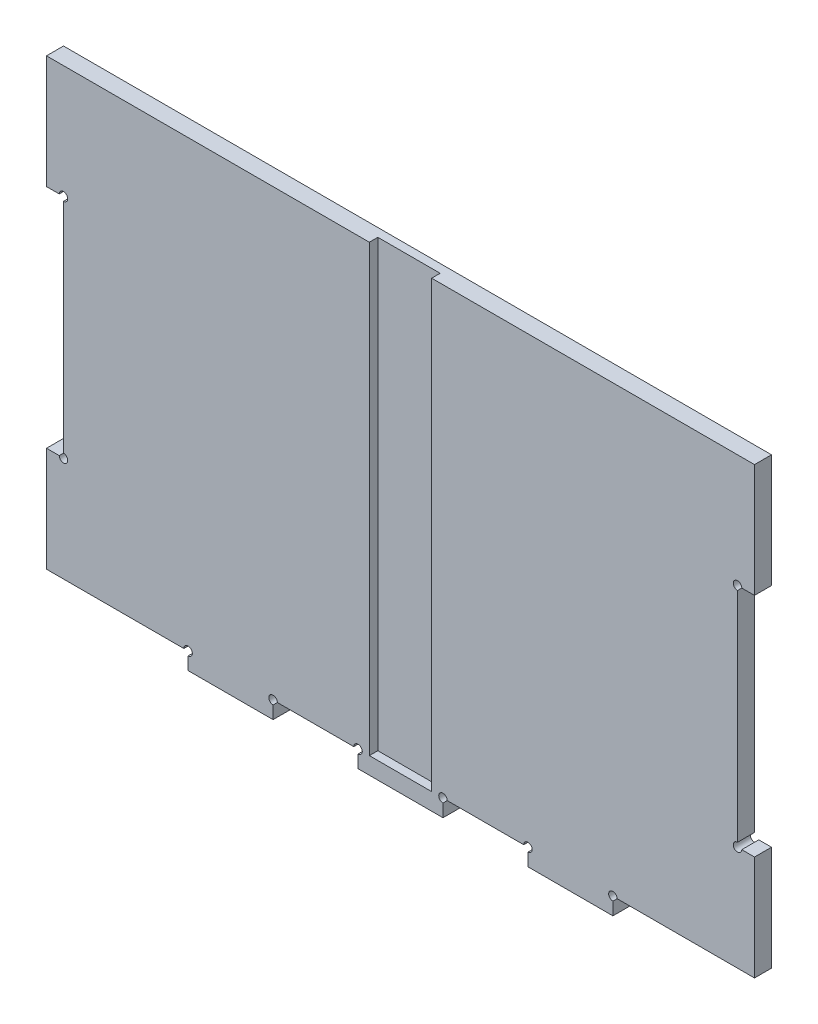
SolidWorks part; units mm, degrees
ref_plane "Plan de face" through (0, 0, 0) normal (0, 0, 1) x (1, 0, 0)
ref_plane "Plan de dessus" through (0, 0, 0) normal (0, 1, 0) x (1, 0, 0)
ref_plane "Plan de droite" through (0, 0, 0) normal (1, 0, 0) x (0, 0, -1)
sketch "Esquisse2" plane through (0, 0, 0) normal (0, 0, 1) x (1, 0, 0)
  line L0 (-63.2091, 120) -> (110, 120)
  line L1 (110, 120) -> (110, 80)
  line L2 (110, 80) -> (104, 80)
  line L3 (104, 80) -> (104, 0)
  line L4 (104, 0) -> (110, 0)
  line L5 (110, 0) -> (110, -37)
  line L6 (110, -37) -> (60, -37)
  line L7 (60, -37) -> (60, -43)
  line L8 (60, -43) -> (30, -43)
  line L9 (30, -43) -> (30, -37)
  line L10 (30, -37) -> (0, -37)
  line L11 (0, -37) -> (0, -43)
  line L12 (0, -43) -> (-30, -43)
  line L13 (-30, -43) -> (-30, -37)
  line L14 (-30, -37) -> (-60, -37)
  line L15 (-60, -37) -> (-60, -43)
  line L16 (-60, -43) -> (-90, -43)
  line L17 (-90, -43) -> (-90, -37)
  line L18 (-90, -37) -> (-140, -37)
  line L19 (-140, -37) -> (-140, 0)
  line L20 (-140, 0) -> (-134, 0)
  line L21 (-134, 0) -> (-134, 80)
  line L22 (-134, 80) -> (-140, 80)
  line L23 (-140, 80) -> (-140, 120)
  line L24 (-140, 120) -> (-63.2091, 120)
  dimension "D1" = 163
  dimension "D2" = 6
  dimension "D3" = 6
  dimension "D4" = 6
  dimension "D5" = 250
  dimension "D6" = 80
  dimension "D7" = 80
  dimension "D8" = 37
  dimension "D9" = 30
  dimension "D10" = 30
  dimension "D11" = 30
  dimension "D12" = 30
  dimension "D13" = 30
  dimension "D14" = 50
extrude "Boss.-Extru.1" add sketch "Esquisse2" along normal blind 6
sketch "Esquisse3" plane through (0, 0, 6) normal (0, 0, 1) x (1, 0, 0)
  circle A0 centre (-134, 80) radius 1.5
  circle A1 centre (-134, 0) radius 1.5
  circle A2 centre (-90, -37) radius 1.5
  circle A3 centre (-60, -37) radius 1.5
  circle A4 centre (-30, -37) radius 1.5
  circle A5 centre (0, -37) radius 1.5
  circle A6 centre (30, -37) radius 1.5
  circle A7 centre (60, -37) radius 1.5
  circle A8 centre (104, 0) radius 1.5
  circle A9 centre (104, 80) radius 1.5
extrude "Enlèv. mat.-Extru.1" cut sketch "Esquisse3" against normal through all
sketch "Esquisse4" plane through (0, 0, 6) normal (0, 0, 1) x (1, 0, 0)
  line L0 (110, 120) -> (-140, 120) construction
  line L1 (-26, 120) -> (-4, 120)
  line L2 (-26, 120) -> (-26, -37)
  line L3 (-26, -37) -> (-4, -37)
  line L4 (-4, 120) -> (-4, -37)
  line L5 (110, 80) -> (110, 120) construction
  line L6 (-140, 120) -> (-140, 80) construction
  line L7 (-58.5, -37) -> (-31.5, -37) construction
  dimension "D1" = 114
  dimension "D2" = 114
  dimension "D3" = 0
extrude "Enlèv. mat.-Extru.2" cut sketch "Esquisse4" against normal blind 3
